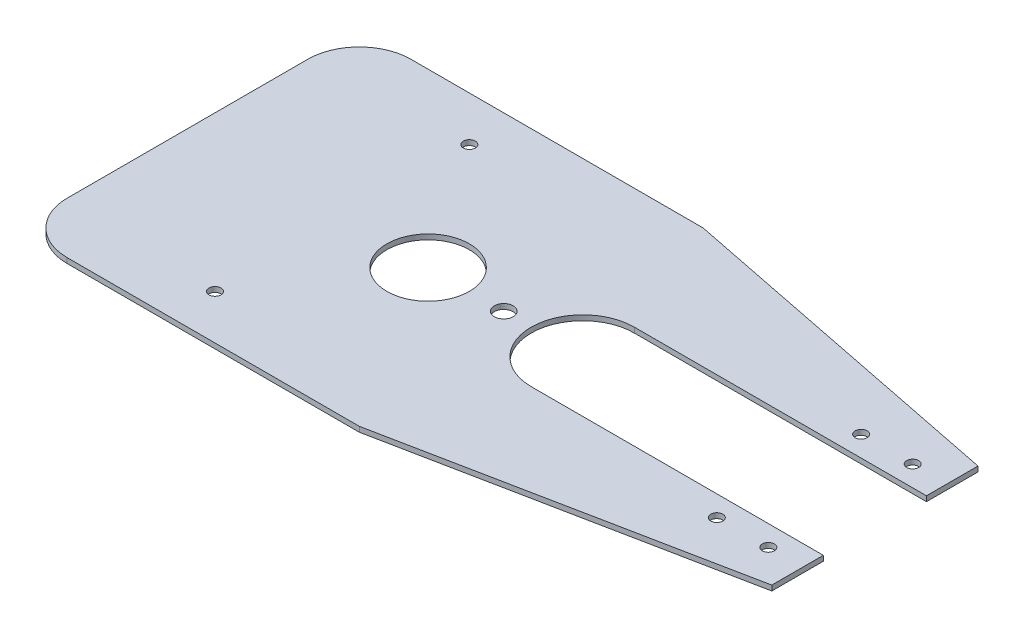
SolidWorks part; units mm, degrees
ref_plane "Front Plane" through (0, 0, 0) normal (0, 0, 1) x (1, 0, 0)
ref_plane "Top Plane" through (0, 0, 0) normal (0, 1, 0) x (1, 0, 0)
ref_plane "Right Plane" through (0, 0, 0) normal (1, 0, 0) x (0, 0, -1)
sketch "Sketch1" plane through (0, 0, 0) normal (0, 1, 0) x (1, 0, 0)
  line L0 (0, 50) -> (200, 50) construction
  line L1 (15, 0) -> (100, 0)
  line L2 (0, 15) -> (0, 85)
  line L3 (15, 100) -> (100, 100)
  line L4 (200, 20) -> (200, 35)
  line L5 (115, 65) -> (200, 65)
  line L6 (115, 35) -> (200, 35)
  line L7 (200, 65) -> (200, 80)
  line L8 (100, 100) -> (100, 0) construction
  line L9 (100, 100) -> (200, 80)
  line L10 (200, 20) -> (100, 0)
  circle A0 centre (70, 50) radius 12
  circle A1 centre (92, 50) radius 2.75
  arc A2 (115, 65) -> (115, 35) centre (115, 50) ccw
  circle A3 centre (190, 71) radius 1.75
  circle A4 centre (175, 71) radius 1.75
  circle A5 centre (175, 29) radius 1.75
  circle A6 centre (190, 29) radius 1.75
  arc A7 (0, 85) -> (15, 100) centre (15, 85) cw
  arc A8 (15, 0) -> (0, 15) centre (15, 15) cw
  circle A9 centre (45, 87) radius 1.75
  circle A10 centre (45, 13) radius 1.75
  point P28 (0, 100)
  point P31 (0, 0)
  dimension "D3" = 24
  dimension "D4" = 5.5
  dimension "D5" = 30
  dimension "D11" = 3.5
  dimension "D12" = 10
  dimension "D13" = 10
  dimension "D21" = 15
  dimension "D22" = 3.5
  dimension "D25" = 45
  dimension "D26" = 45
  dimension "D1" = 100
  dimension "D2" = 200
  dimension "D6" = 70
  dimension "D7" = 22
  dimension "D8" = 85
  dimension "D9" = 15
  dimension "D10" = 15
  dimension "D14" = 15
  dimension "D15" = 15
  dimension "D16" = 21
  dimension "D17" = 21
  dimension "D18" = 21
  dimension "D19" = 21
  dimension "D20" = 100
  dimension "D23" = 37
  dimension "D24" = 37
extrude "Extrude1" add sketch "Sketch1" along normal blind 1.5
